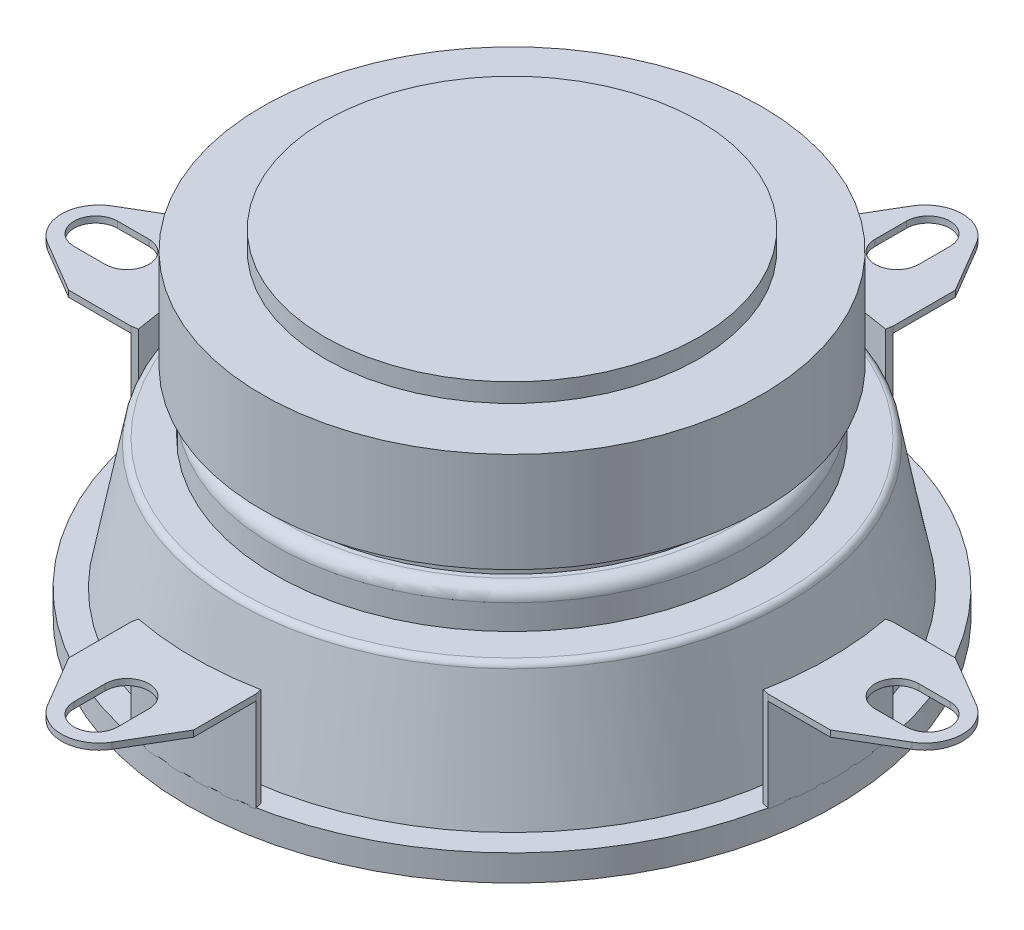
SolidWorks part; units mm, degrees
ref_plane "Спереди" through (0, 0, 0) normal (0, 0, 1) x (1, 0, 0)
ref_plane "Сверху" through (0, 0, 0) normal (0, 1, 0) x (1, 0, 0)
ref_plane "Справа" through (0, 0, 0) normal (1, 0, 0) x (0, 0, -1)
sketch "Sketch1" plane through (0, 0, 0) normal (0, 1, 0) x (1, 0, 0)
  circle A0 centre (0, 0) radius 26
  dimension "D1" = 52
sketch "Sketch2" plane through (0, 0, 0) normal (0, 0, 1) x (1, 0, 0)
  line L0 (26, 0) -> (26, 2.0944)
  line L1 (26, 0) -> (-26, 0) construction
  line L2 (26, 2.0944) -> (24, 2.0944)
  line L3 (24, 2.0944) -> (22.078, 12.0944)
  line L4 (21.587, 12.5) -> (19, 12.5)
  line L5 (19, 12.5) -> (19, 14.5)
  line L6 (18, 15.5) -> (17.6179, 15.5)
  line L7 (17.6179, 15.5) -> (17.6179, 17.5)
  line L8 (17.6179, 17.5) -> (20, 17.5)
  line L9 (20, 17.5) -> (20, 25.5)
  line L10 (20, 25.5) -> (15, 25.5)
  line L11 (15, 25.5) -> (15, 27)
  line L12 (15, 27) -> (0, 27)
  line L13 (0, 27) -> (0, 0)
  line L14 (0, 0) -> (26, 0)
  line L15 (0, 0) -> (0, 24.0665) construction
  arc A0 (19, 14.5) -> (18, 15.5) centre (18, 14.5) ccw
  arc A1 (22.078, 12.0944) -> (21.587, 12.5) centre (21.587, 12) ccw
  point P25 (22, 12.5)
  dimension "D7" = 1
  dimension "D12" = 0.5
  dimension "D1" = 40
  dimension "D2" = 8
  dimension "D3" = 1.5
  dimension "D4" = 27
  dimension "D5" = 2
  dimension "D6" = 2
  dimension "D8" = 2
  dimension "D9" = 3
  dimension "D10" = 3
  dimension "D11" = 2
  dimension "D13" = 10
  dimension "D14" = 5
revolve "Revolve1" add sketch "Sketch2" angle 360 about L15
sketch "Sketch3" plane through (0, 0, 0) normal (0, 0, 1) x (1, 0, 0)
  line L0 (21.1894, 3.0167) -> (23.0081, 3.0167)
  line L1 (23.0081, 3.0167) -> (23.5879, 0)
  line L2 (26, 0) -> (-26, 0) construction
  line L3 (24, 2.0944) -> (22.078, 12.0944) construction
  line L4 (0, 0) -> (0, 10.1569) construction
  line L5 (0, 4.9596) -> (-3.757, 4.9596) construction
  line L6 (23.5879, 0) -> (23.5879, -1.3699)
  line L7 (23.5879, -1.3699) -> (0, -1.0054)
  line L8 (0, -1.0054) -> (0, 4.9596)
  arc A0 (21.1894, 3.0167) -> (16.2656, 2.1678) centre (18.7434, 2.5) cw
  arc A1 (16.2656, 2.1678) -> (0, 4.9596) centre (0, -43.8191) ccw
  dimension "D2" = 2.5
  dimension "D1" = 0.8
revolve "Cut-Revolve1" cut sketch "Sketch3" angle 360 about L4
sketch "Sketch4" plane through (0, 0, 0) normal (0, 1, 0) x (1, 0, 0)
  line L0 (0, 0) -> (0, -39.6528) construction
  line L1 (-5, -25.5147) -> (-5, -30.5147)
  line L2 (-5, -30.5147) -> (-2.5847, -34.6137)
  line L3 (5, -25.5147) -> (5, -30.5147)
  line L4 (5, -30.5147) -> (2.5847, -34.6137)
  arc A0 (-5, -25.5147) -> (5, -25.5147) centre (0, 0) ccw
  circle A2 centre (0, 0) radius 26 construction
  arc A3 (-2.5847, -34.6137) -> (2.5847, -34.6137) centre (0, -33.0907) ccw
  point P13 (0, -39)
  dimension "D4" = 3
  dimension "D5" = 10.0907
  dimension "D1" = 10
  dimension "D2" = 13
  dimension "D3" = 5
extrude "Boss-Extrude1" add sketch "Sketch4" against normal blind 0.5 from offset 10 separate body
sketch "Sketch5" plane through (0, 10, 0) normal (0, 1, 0) x (-1, 0, 0)
  arc A0 (5, 25.5147) -> (-5, 25.5147) centre (0, 0) ccw construction
  arc A1 (5, 25.5147) -> (-5, 25.5147) centre (0, 0) ccw
extrude "Extrude-Thin1" add sketch "Sketch5" against normal blind 8 thin
sketch "Sketch6" plane through (0, 10, 0) normal (0, 1, 0) x (-1, 0, 0)
  line L0 (0, 0) -> (0, 36.0907) construction
  line L1 (0, 30.8407) -> (0, 33.3407) construction
  line L2 (-1.75, 30.8407) -> (-1.75, 33.3407)
  line L3 (1.75, 30.8407) -> (1.75, 33.3407)
  arc A1 (-1.75, 30.8407) -> (1.75, 30.8407) centre (0, 30.8407) ccw
  arc A2 (1.75, 33.3407) -> (-1.75, 33.3407) centre (0, 33.3407) ccw
  arc A3 (2.5847, 34.6137) -> (-2.5847, 34.6137) centre (0, 33.0907) ccw construction
  point P3 (0, 32.0907)
  dimension "D2" = 1
  dimension "D3" = 6
  dimension "D1" = 3.5
extrude "Cut-Extrude1" cut sketch "Sketch6" against normal blind 9
pattern_circular "CirPattern2" count 4 over 360 about axis through (0, 0, 0) along (0, 1, 0)
ref_plane "Plane1" through (0, 0, 0) normal (-0.7071, 0, 0.7071) x (0.7071, 0, 0.7071)
sketch "Sketch7" plane through (0, 0, 0) normal (0, 1, 0) x (1, 0, 0)
  line L0 (26.8449, 26.8449) -> (-26.8449, -26.8449) construction
  line L1 (0, 0) -> (0, 11.1954) construction
  point P2 (0, 0)
  dimension "D1" = 45
ref_plane "Plane2" through (0, 0, 0) normal (-0.7071, 0, -0.7071) x (-0.7071, 0, 0.7071)
